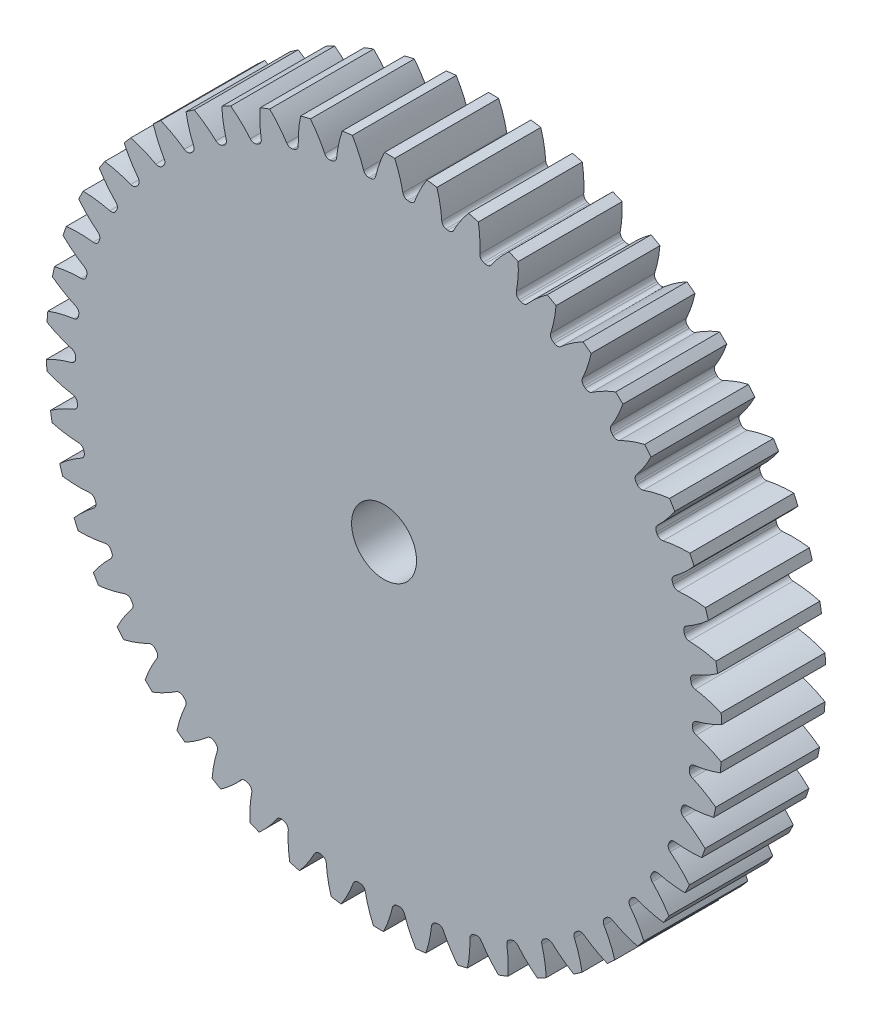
SolidWorks part; units mm, degrees
ref_plane "Front" through (0, 0, 0) normal (0, 0, 1) x (1, 0, 0)
ref_plane "Top" through (0, 0, 0) normal (0, 1, 0) x (1, 0, 0)
ref_plane "Right" through (0, 0, 0) normal (1, 0, 0) x (0, 0, -1)
sketch "Sketch3" plane through (0, 0, 0) normal (0, 0, 1) x (1, 0, 0)
  circle A0 centre (0, 0) radius 330.2
  dimension "od" = 660.4
extrude "gearBody" add sketch "Sketch3" along normal blind 101.6
sketch "Sketch2" plane through (0, 0, 0) normal (0, 0, 1) x (1, 0, 0)
  line L0 (0, 0) -> (275.6417, 114.1745) construction
  line L1 (329.6702, -21.3952) -> (0, 0) construction
  line L2 (0, 0) -> (36.3143, 0) construction
  line L3 (317.466, 4.647) -> (317.135, -15.2202) construction
  line L5 (317.3005, -5.2866) -> (0, 0) construction
  line L7 (0, 0) -> (298.3524, 0) construction
  arc A0 (298.3512, -0.8465) -> (298.2138, -9.093) centre (0, 0) ccw construction
  arc A1 (330.0388, 10.3164) -> (329.5119, -21.3053) centre (0, 0) ccw construction
  arc A2 (317.466, 4.647) -> (317.135, -15.2202) centre (0, 0) ccw construction
  arc A3 (301.5671, -5.9073) -> (301.5966, -4.1421) centre (0, 0) ccw
  arc A4 (329.6702, -21.3952) -> (305.255, -10.961) centre (271.6852, -123.2936) ccw
  arc A5 (329.6702, -21.3952) -> (330.2, 10.401) centre (0, 0) ccw
  arc A6 (330.2, 10.401) -> (305.4508, 0.7859) centre (275.6417, 114.1745) cw
  arc A7 (301.5966, -4.1421) -> (305.4508, 0.7859) centre (306.765, -4.2131) cw
  arc A8 (305.255, -10.961) -> (301.5671, -5.9073) centre (306.7351, -6.0085) cw
  point P6 (330.2, 10.401)
  point P22 (329.6702, -21.3952)
  dimension "baseDia" = 596.7048
  dimension "od" = 660.4
  dimension "pd" = 635
  dimension "rd" = 603.25
  dimension "rFillet" = 5.1689
  dimension "pointX" = 330.2
  dimension "pointY" = 10.401
  dimension "CTT" = 19.8672
  dimension "flankCenterAngle" = 22.5
extrude "toothCut" cut sketch "Sketch2" along normal through all
pattern_circular "CirPattern1" count 50 over 360 about axis through (0, 0, 0) along (0, 0, 1) of "toothCut"
sketch "hub1Dia" plane through (0, 0, 0) normal (0, 0, -1) x (-1, 0, 0)
  circle A0 centre (0, 0) radius 12.7
  dimension "hub1Dia" = 25.4
sketch "hub2Dia" plane through (0, 0, 101.6) normal (0, 0, 1) x (1, 0, 0)
  circle A0 centre (0, 0) radius 12.7
  dimension "hub2dia" = 25.4
sketch "boreDia" plane through (0, 0, 0) normal (0, 0, 1) x (1, 0, 0)
  circle A0 centre (0, 0) radius 31.75
  dimension "boreDia" = 63.5
extrude "bore" cut sketch "boreDia" against normal mid plane 25400
